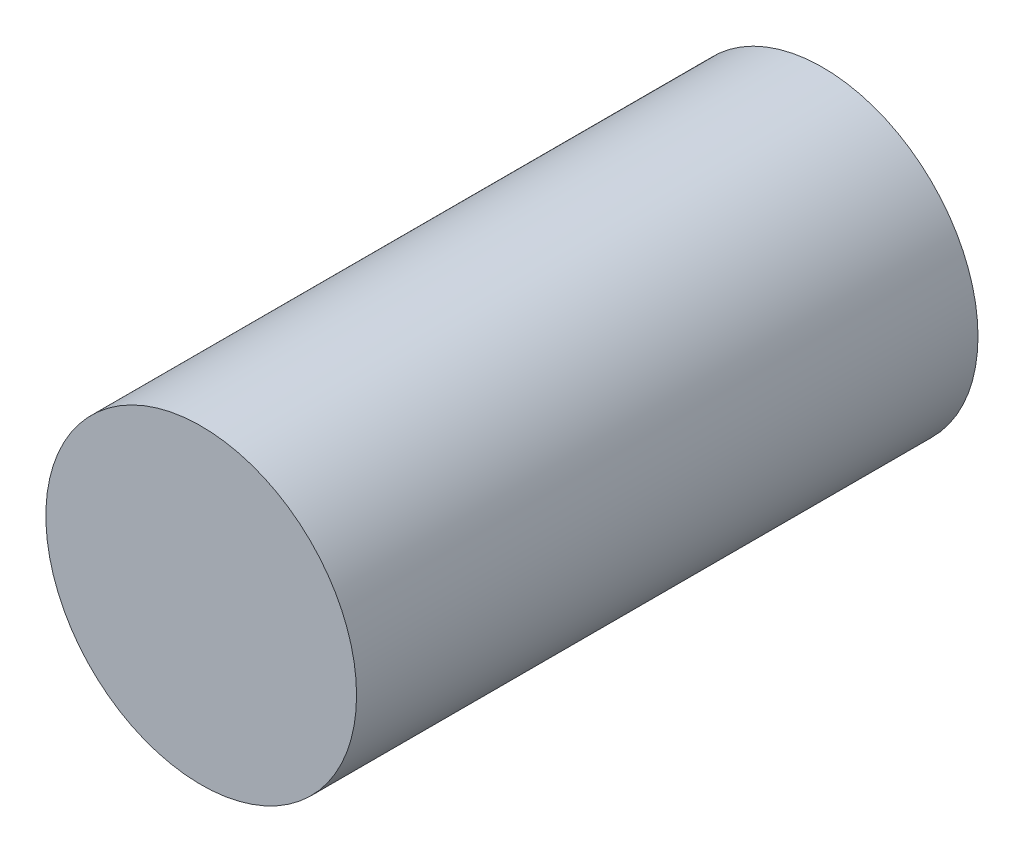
SolidWorks part; units mm, degrees
ref_plane "Front Plane" through (0, 0, 0) normal (0, 0, 1) x (1, 0, 0)
ref_plane "Top Plane" through (0, 0, 0) normal (0, 1, 0) x (1, 0, 0)
ref_plane "Right Plane" through (0, 0, 0) normal (1, 0, 0) x (0, 0, -1)
sketch "Sketch1" plane through (0, 0, 0) normal (0, 0, 1) x (1, 0, 0)
  circle A0 centre (0, 0) radius 0.75
  dimension "D1" = 1.5
extrude "Boss-Extrude1" add sketch "Sketch1" along normal blind 3
